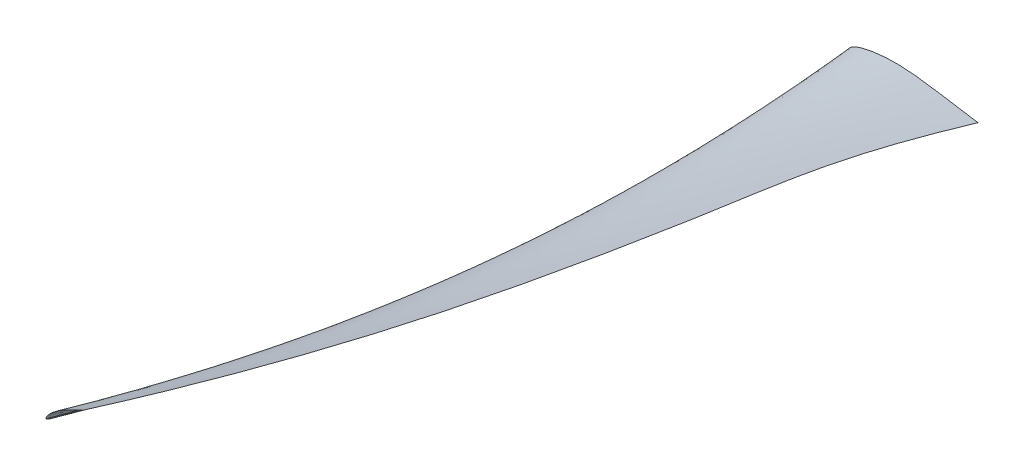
SolidWorks part; units mm, degrees
ref_plane "Plan de face" through (0, 0, 0) normal (0, 0, 1) x (1, 0, 0)
ref_plane "Plan de dessus" through (0, 0, 0) normal (0, 1, 0) x (1, 0, 0)
ref_plane "Plan de droite" through (0, 0, 0) normal (1, 0, 0) x (0, 0, -1)
ref_plane "Plan7" through (0, 0, 0) normal (0, 0, 1) x (1, 0, 0)
sketch "Esquisse7" plane through (0, 0, 0) normal (0, 0, 1) x (1, 0, 0)
  spline S0 degree 3 poles (0, 0) (0.01, 0.0779) (0.0566, 0.4389) (0.6038, 1.0375) (1.4835, 1.8363) (2.8511, 2.6404) (4.5884, 3.488) (6.7468, 4.3064) (9.2893, 5.0773) (12.1913, 5.8344) (15.4386, 6.4858) (18.9898, 7.0761) (22.8127, 7.5599) (26.8712, 7.9384) (31.13, 8.1902) (35.5567, 8.2799) (40.1224, 8.1907) (44.8051, 7.965) (49.5765, 7.5702) (54.409, 7.0333) (59.2707, 6.3995) (64.1131, 5.711) (68.879, 4.9915) (73.5011, 4.2633) (77.92, 3.5536) (82.0778, 2.8904) (85.909, 2.2574) (89.3679, 1.7074) (92.3959, 1.2022) (94.9606, 0.7907) (97.0187, 0.4452) (98.5362, 0.2104) (99.4689, 0.0649) (99.8933, 0.013) (100, 0) knots 0 0 0 0 0.002279 0.010565 0.02232 0.037625 0.05653 0.079028 0.105089 0.134331 0.166822 0.202049 0.239744 0.279649 0.321405 0.364661 0.409281 0.455122 0.50194 0.549472 0.597507 0.645525 0.692715 0.738665 0.78256 0.823791 0.861972 0.896286 0.926362 0.95188 0.972359 0.987477 0.996852 1 1 1 1
  spline S1 degree 3 poles (0, 0) (0.0216, -0.1028) (0.0957, -0.4562) (0.906, -0.754) (2.0288, -1.0924) (3.7758, -1.3043) (5.9941, -1.458) (8.7342, -1.512) (11.9532, -1.5081) (15.6306, -1.4432) (19.7237, -1.331) (24.1903, -1.1785) (28.9802, -0.9996) (34.0362, -0.7913) (39.3002, -0.6124) (44.7029, -0.4031) (50.183, -0.2273) (55.6731, -0.0668) (61.1032, 0.07) (66.4063, 0.1967) (71.5165, 0.2722) (76.3699, 0.3249) (80.9033, 0.3414) (85.0567, 0.3468) (88.7835, 0.3163) (92.0301, 0.2654) (94.7571, 0.2109) (96.9234, 0.1366) (98.5004, 0.0831) (99.4602, 0.0331) (99.89, 0.0068) (100, 0) knots 0 0 0 0 0.003023 0.010401 0.022533 0.03974 0.062002 0.089293 0.121454 0.1582 0.199139 0.243771 0.291698 0.342319 0.394926 0.44903 0.503823 0.558709 0.613093 0.666078 0.717164 0.765757 0.811062 0.852583 0.889823 0.922387 0.949576 0.971293 0.987136 0.996708 1 1 1 1
ref_plane "Plan8" through (0, 0, 100) normal (0, 0, 1) x (1, 0, 0)
sketch "Esquisse8" plane through (0, 0, 100) normal (0, 0, 1) x (1, 0, 0)
  line L0 (0, 0) -> (19.9239, 1.7431) construction
  line L1 (19.9239, 1.7431) -> (19.0523, 11.7051) construction
  line L2 (0, 0) -> (19.9239, 1.7431) construction
  line L3 (19.9239, 1.7431) -> (19.0523, 11.7051) construction
  spline S0 degree 3 poles (19.0523, 11.7051) (19.0546, 11.7605) (19.0651, 12.0177) (19.4137, 12.4731) (19.9842, 13.09) (20.8979, 13.7407) (22.0695, 14.4449) (23.5395, 15.1543) (25.283, 15.8541) (27.2805, 16.5662) (29.5278, 17.2252) (31.993, 17.8599) (34.6561, 18.4363) (37.4916, 18.953) (40.4761, 19.3928) (43.5887, 19.7288) (46.8104, 19.9474) (50.1229, 20.077) (53.5083, 20.0929) (56.9454, 20.0126) (60.4092, 19.8657) (63.8627, 19.6792) (67.2642, 19.4661) (70.5649, 19.2379) (73.7215, 19.0104) (76.6911, 18.7994) (79.4289, 18.5897) (81.8993, 18.4154) (84.0634, 18.2461) (85.8954, 18.1143) (87.3664, 17.9978) (88.4498, 17.9259) (89.1158, 17.8809) (89.418, 17.8705) (89.4939, 17.8679) knots 0 0 0 0 0.002279 0.010565 0.02232 0.037625 0.05653 0.079028 0.105089 0.134331 0.166822 0.202049 0.239744 0.279649 0.321405 0.364661 0.409281 0.455122 0.50194 0.549472 0.597507 0.645525 0.692715 0.738665 0.78256 0.823791 0.861972 0.896286 0.926362 0.95188 0.972359 0.987477 0.996852 1 1 1 1
  spline S1 degree 3 poles (19.0523, 11.7051) (19.0739, 11.634) (19.1479, 11.3896) (19.737, 11.2298) (20.5488, 11.0606) (21.7925, 11.019) (23.3645, 11.0474) (25.298, 11.1782) (27.5653, 11.3794) (30.1517, 11.6517) (33.0281, 11.983) (36.165, 12.3657) (39.5281, 12.7869) (43.0768, 13.2453) (46.7738, 13.6957) (50.5666, 14.1761) (54.4161, 14.6376) (58.2734, 15.0891) (62.0901, 15.5201) (65.8179, 15.9361) (69.4129, 16.3043) (72.8285, 16.6405) (76.0209, 16.9315) (78.9463, 17.1912) (81.5734, 17.3994) (83.8635, 17.5637) (85.7877, 17.6934) (87.3183, 17.7745) (88.4325, 17.834) (89.1116, 17.858) (89.416, 17.8659) (89.4939, 17.8679) knots 0 0 0 0 0.003023 0.010401 0.022533 0.03974 0.062002 0.089293 0.121454 0.1582 0.199139 0.243771 0.291698 0.342319 0.394926 0.44903 0.503823 0.558709 0.613093 0.666078 0.717164 0.765757 0.811062 0.852583 0.889823 0.922387 0.949576 0.971293 0.987136 0.996708 1 1 1 1
ref_plane "Plan9" through (0, 0, 200) normal (0, 0, 1) x (1, 0, 0)
sketch "Esquisse9" plane through (0, 0, 200) normal (0, 0, 1) x (1, 0, 0)
  line L0 (0, 0) -> (39.3923, 6.9459) construction
  line L1 (39.3923, 6.9459) -> (35.9193, 26.6421) construction
  line L2 (0, 0) -> (39.3923, 6.9459) construction
  line L3 (39.3923, 6.9459) -> (35.9193, 26.6421) construction
  spline S0 degree 3 poles (35.9193, 26.6421) (35.9172, 26.6874) (35.9075, 26.8973) (36.1586, 27.2925) (36.5787, 27.8349) (37.2757, 28.4292) (38.1785, 29.0853) (39.3237, 29.767) (40.692, 30.4602) (42.2661, 31.1816) (44.0472, 31.8776) (46.0071, 32.5693) (48.1323, 33.2276) (50.4019, 33.8497) (52.7981, 34.4198) (55.306, 34.9146) (57.9109, 35.3216) (60.5961, 35.6628) (63.3486, 35.9166) (66.15, 36.0959) (68.9778, 36.2229) (71.8001, 36.317) (74.582, 36.3857) (77.2831, 36.435) (79.8668, 36.4745) (82.2973, 36.5143) (84.5391, 36.5385) (86.5609, 36.5725) (88.3332, 36.5888) (89.8327, 36.612) (91.0375, 36.6219) (91.9238, 36.6405) (92.4687, 36.6513) (92.7153, 36.6644) (92.7772, 36.6677) knots 0 0 0 0 0.002279 0.010565 0.02232 0.037625 0.05653 0.079028 0.105089 0.134331 0.166822 0.202049 0.239744 0.279649 0.321405 0.364661 0.409281 0.455122 0.50194 0.549472 0.597507 0.645525 0.692715 0.738665 0.78256 0.823791 0.861972 0.896286 0.926362 0.95188 0.972359 0.987477 0.996852 1 1 1 1
  spline S1 degree 3 poles (35.9193, 26.6421) (35.9419, 26.5858) (36.0195, 26.3923) (36.51, 26.3042) (37.1824, 26.2243) (38.197, 26.2791) (39.4736, 26.414) (41.037, 26.658) (42.8669, 26.983) (44.9513, 27.3886) (47.2673, 27.8627) (49.7916, 28.3972) (52.4971, 28.9791) (55.351, 29.6045) (58.326, 30.2339) (61.3769, 30.8946) (64.4752, 31.544) (67.5806, 32.1857) (70.6543, 32.8078) (73.6568, 33.4115) (76.5548, 33.9668) (79.3091, 34.4833) (81.885, 34.9472) (84.246, 35.3667) (86.3681, 35.723) (88.2192, 36.0195) (89.7751, 36.2619) (91.0143, 36.4369) (91.9163, 36.5646) (92.467, 36.6324) (92.714, 36.6605) (92.7772, 36.6677) knots 0 0 0 0 0.003023 0.010401 0.022533 0.03974 0.062002 0.089293 0.121454 0.1582 0.199139 0.243771 0.291698 0.342319 0.394926 0.44903 0.503823 0.558709 0.613093 0.666078 0.717164 0.765757 0.811062 0.852583 0.889823 0.922387 0.949576 0.971293 0.987136 0.996708 1 1 1 1
ref_plane "Plan10" through (0, 0, 300) normal (0, 0, 1) x (1, 0, 0)
sketch "Esquisse10" plane through (0, 0, 300) normal (0, 0, 1) x (1, 0, 0)
  line L0 (0, 0) -> (57.9555, 15.5291) construction
  line L1 (57.9555, 15.5291) -> (50.191, 44.5069) construction
  line L2 (0, 0) -> (57.9555, 15.5291) construction
  line L3 (57.9555, 15.5291) -> (50.191, 44.5069) construction
  spline S0 degree 3 poles (50.191, 44.5069) (50.1857, 44.5458) (50.1615, 44.7262) (50.3483, 45.0861) (50.6698, 45.5857) (51.2262, 46.1511) (51.9556, 46.7853) (52.8922, 47.4598) (54.0203, 48.1612) (55.3239, 48.9024) (56.8079, 49.6372) (58.4466, 50.3819) (60.2303, 51.1103) (62.1415, 51.8183) (64.1657, 52.491) (66.292, 53.1072) (68.5087, 53.6549) (70.7994, 54.1519) (73.1549, 54.5787) (75.5583, 54.9448) (77.9884, 55.2678) (80.4162, 55.562) (82.811, 55.8312) (85.1376, 56.0777) (87.3636, 56.3068) (89.4575, 56.5245) (91.3897, 56.7146) (93.1314, 56.8966) (94.6592, 57.0444) (95.9511, 57.1776) (96.9898, 57.2771) (97.7531, 57.36) (98.2223, 57.4105) (98.434, 57.4404) (98.4873, 57.4479) knots 0 0 0 0 0.002279 0.010565 0.02232 0.037625 0.05653 0.079028 0.105089 0.134331 0.166822 0.202049 0.239744 0.279649 0.321405 0.364661 0.409281 0.455122 0.50194 0.549472 0.597507 0.645525 0.692715 0.738665 0.78256 0.823791 0.861972 0.896286 0.926362 0.95188 0.972359 0.987477 0.996852 1 1 1 1
  spline S1 degree 3 poles (50.191, 44.5069) (50.2147, 44.4601) (50.2962, 44.299) (50.7261, 44.26) (51.3122, 44.2419) (52.1833, 44.3656) (53.2746, 44.5784) (54.6049, 44.907) (56.1591, 45.3254) (57.9267, 45.8326) (59.8891, 46.4165) (62.0265, 47.0682) (64.3167, 47.7744) (66.7316, 48.5294) (69.2508, 49.297) (71.833, 50.0972) (74.4569, 50.8913) (77.0876, 51.6793) (79.6925, 52.4481) (82.2373, 53.1955) (84.6956, 53.8933) (87.0328, 54.5468) (89.2201, 55.1415) (91.2253, 55.6815) (93.0292, 56.1491) (94.6038, 56.5447) (95.9278, 56.8712) (96.9837, 57.1157) (97.7523, 57.2939) (98.2223, 57.394) (98.4333, 57.4369) (98.4873, 57.4479) knots 0 0 0 0 0.003023 0.010401 0.022533 0.03974 0.062002 0.089293 0.121454 0.1582 0.199139 0.243771 0.291698 0.342319 0.394926 0.44903 0.503823 0.558709 0.613093 0.666078 0.717164 0.765757 0.811062 0.852583 0.889823 0.922387 0.949576 0.971293 0.987136 0.996708 1 1 1 1
ref_plane "Plan11" through (0, 0, 400) normal (0, 0, 1) x (1, 0, 0)
sketch "Esquisse11" plane through (0, 0, 400) normal (0, 0, 1) x (1, 0, 0)
  line L0 (0, 0) -> (75.1754, 27.3616) construction
  line L1 (75.1754, 27.3616) -> (61.4946, 64.9493) construction
  line L2 (0, 0) -> (75.1754, 27.3616) construction
  line L3 (75.1754, 27.3616) -> (61.4946, 64.9493) construction
  spline S0 degree 3 poles (61.4946, 64.9493) (61.4869, 64.9836) (61.4513, 65.1424) (61.5896, 65.4777) (61.8372, 65.9479) (62.2889, 66.495) (62.8893, 67.117) (63.6712, 67.791) (64.6218, 68.5039) (65.7255, 69.2659) (66.9905, 70.0364) (68.3926, 70.8276) (69.9252, 71.6157) (71.5728, 72.3955) (73.324, 73.1527) (75.1706, 73.8675) (77.103, 74.5284) (79.1054, 75.1498) (81.1709, 75.7136) (83.2838, 76.2272) (85.4239, 76.7045) (87.5642, 77.1558) (89.677, 77.5824) (91.7308, 77.9834) (93.6964, 78.361) (95.5452, 78.7183) (97.252, 79.0383) (98.7897, 79.3362) (100.1395, 79.587) (101.2802, 79.8064) (102.198, 79.976) (102.8716, 80.1094) (103.2858, 80.191) (103.4721, 80.2341) (103.5189, 80.2449) knots 0 0 0 0 0.002279 0.010565 0.02232 0.037625 0.05653 0.079028 0.105089 0.134331 0.166822 0.202049 0.239744 0.279649 0.321405 0.364661 0.409281 0.455122 0.50194 0.549472 0.597507 0.645525 0.692715 0.738665 0.78256 0.823791 0.861972 0.896286 0.926362 0.95188 0.972359 0.987477 0.996852 1 1 1 1
  spline S1 degree 3 poles (61.4946, 64.9493) (61.5194, 64.9094) (61.6046, 64.7722) (61.9906, 64.771) (62.5143, 64.8005) (63.2809, 64.9787) (64.2366, 65.2534) (65.3964, 65.6499) (66.7485, 66.1439) (68.284, 66.7336) (69.987, 67.4068) (71.8407, 68.1541) (73.8263, 68.9619) (75.9191, 69.8228) (78.1039, 70.7032) (80.3423, 71.6175) (82.6185, 72.5296) (84.901, 73.4368) (87.1621, 74.3248) (89.3713, 75.1892) (91.5073, 76.0026) (93.5388, 76.7671) (95.4415, 77.4674) (97.1861, 78.105) (98.7569, 78.6622) (100.1291, 79.1374) (101.2834, 79.5316) (102.2051, 79.8317) (102.876, 80.0505) (103.287, 80.1763) (103.4717, 80.2309) (103.5189, 80.2449) knots 0 0 0 0 0.003023 0.010401 0.022533 0.03974 0.062002 0.089293 0.121454 0.1582 0.199139 0.243771 0.291698 0.342319 0.394926 0.44903 0.503823 0.558709 0.613093 0.666078 0.717164 0.765757 0.811062 0.852583 0.889823 0.922387 0.949576 0.971293 0.987136 0.996708 1 1 1 1
ref_plane "Plan12" through (0, 0, 500) normal (0, 0, 1) x (1, 0, 0)
sketch "Esquisse12" plane through (0, 0, 500) normal (0, 0, 1) x (1, 0, 0)
  line L0 (0, 0) -> (90.6308, 42.2618) construction
  line L1 (90.6308, 42.2618) -> (69.4999, 87.5772) construction
  line L2 (0, 0) -> (90.6308, 42.2618) construction
  line L3 (90.6308, 42.2618) -> (69.4999, 87.5772) construction
  spline S0 degree 3 poles (69.4999, 87.5772) (69.4901, 87.6078) (69.4451, 87.7494) (69.5443, 88.0653) (69.7319, 88.5126) (70.0992, 89.0461) (70.5958, 89.6594) (71.2532, 90.3346) (72.0609, 91.0585) (73.004, 91.8393) (74.0931, 92.6406) (75.3052, 93.4717) (76.6362, 94.3103) (78.0725, 95.1506) (79.6048, 95.9785) (81.2272, 96.7755) (82.9319, 97.5302) (84.7035, 98.2546) (86.537, 98.9318) (88.4176, 99.5669) (90.3258, 100.1712) (92.2363, 100.7519) (94.1238, 101.308) (95.9596, 101.836) (97.7171, 102.3358) (99.3698, 102.8078) (100.8966, 103.2346) (102.2713, 103.6279) (103.4788, 103.9634) (104.4987, 104.2536) (105.3198, 104.4809) (105.9218, 104.6558) (106.292, 104.7629) (106.458, 104.8169) (106.4997, 104.8305) knots 0 0 0 0 0.002279 0.010565 0.02232 0.037625 0.05653 0.079028 0.105089 0.134331 0.166822 0.202049 0.239744 0.279649 0.321405 0.364661 0.409281 0.455122 0.50194 0.549472 0.597507 0.645525 0.692715 0.738665 0.78256 0.823791 0.861972 0.896286 0.926362 0.95188 0.972359 0.987477 0.996852 1 1 1 1
  spline S1 degree 3 poles (69.4999, 87.5772) (69.5256, 87.5429) (69.614, 87.4249) (69.9651, 87.4546) (70.439, 87.523) (71.1219, 87.7461) (71.9692, 88.0719) (72.9924, 88.5247) (74.1827, 89.0816) (75.5322, 89.74) (77.0273, 90.4877) (78.6536, 91.3148) (80.395, 92.2074) (82.2297, 93.1568) (84.1466, 94.1312) (86.1094, 95.1408) (88.1067, 96.1514) (90.1103, 97.158) (92.0959, 98.1454) (94.0362, 99.1073) (95.9139, 100.0169) (97.7006, 100.8738) (99.3751, 101.662) (100.9109, 102.3806) (102.2951, 103.0123) (103.5051, 103.5537) (104.5235, 104.004) (105.3378, 104.3503) (105.9305, 104.6026) (106.2943, 104.7497) (106.4579, 104.8141) (106.4997, 104.8305) knots 0 0 0 0 0.003023 0.010401 0.022533 0.03974 0.062002 0.089293 0.121454 0.1582 0.199139 0.243771 0.291698 0.342319 0.394926 0.44903 0.503823 0.558709 0.613093 0.666078 0.717164 0.765757 0.811062 0.852583 0.889823 0.922387 0.949576 0.971293 0.987136 0.996708 1 1 1 1
ref_plane "Plan13" through (0, 0, 600) normal (0, 0, 1) x (1, 0, 0)
sketch "Esquisse13" plane through (0, 0, 600) normal (0, 0, 1) x (1, 0, 0)
  line L0 (0, 0) -> (103.923, 60) construction
  line L1 (103.923, 60) -> (73.923, 111.9615) construction
  line L2 (0, 0) -> (103.923, 60) construction
  line L3 (103.923, 60) -> (73.923, 111.9615) construction
  spline S0 degree 3 poles (73.923, 111.9615) (73.9116, 111.9889) (73.8586, 112.1159) (73.9246, 112.4152) (74.0616, 112.8429) (74.3573, 113.3646) (74.7658, 113.9704) (75.3176, 114.6461) (76.0042, 115.379) (76.811, 116.1752) (77.7508, 117.0021) (78.8016, 117.8665) (79.9616, 118.7473) (81.2185, 119.6382) (82.5649, 120.5254) (83.9969, 121.3913) (85.5083, 122.225) (87.0837, 123.036) (88.7201, 123.8085) (90.4034, 124.546) (92.1145, 125.2574) (93.8297, 125.9471) (95.5257, 126.6123) (97.1762, 127.2474) (98.7568, 127.8502) (100.2431, 128.4189) (101.6168, 128.9357) (102.8529, 129.4094) (103.9395, 129.8162) (104.8568, 130.1662) (105.5957, 130.4421) (106.1368, 130.652) (106.4696, 130.7806) (106.6183, 130.8438) (106.6557, 130.8597) knots 0 0 0 0 0.002279 0.010565 0.02232 0.037625 0.05653 0.079028 0.105089 0.134331 0.166822 0.202049 0.239744 0.279649 0.321405 0.364661 0.409281 0.455122 0.50194 0.549472 0.597507 0.645525 0.692715 0.738665 0.78256 0.823791 0.861972 0.896286 0.926362 0.95188 0.972359 0.987477 0.996852 1 1 1 1
  spline S1 degree 3 poles (73.923, 111.9615) (73.9495, 111.932) (74.0406, 111.8303) (74.3621, 111.8859) (74.7936, 111.9873) (75.4055, 112.2482) (76.1606, 112.6171) (77.0677, 113.1172) (78.1206, 113.7268) (79.3121, 114.443) (80.6307, 115.2533) (82.0639, 116.1473) (83.598, 117.1111) (85.2135, 118.1348) (86.9028, 119.1881) (88.6317, 120.2776) (90.3923, 121.3708) (92.159, 122.4609) (93.9105, 123.5319) (95.6224, 124.5755) (97.2809, 125.566) (98.8596, 126.5004) (100.3404, 127.3626) (101.6989, 128.1492) (102.9245, 128.8435) (103.9968, 129.4405) (104.8997, 129.938) (105.6229, 130.323) (106.1492, 130.6036) (106.4728, 130.7686) (106.6185, 130.8412) (106.6557, 130.8597) knots 0 0 0 0 0.003023 0.010401 0.022533 0.03974 0.062002 0.089293 0.121454 0.1582 0.199139 0.243771 0.291698 0.342319 0.394926 0.44903 0.503823 0.558709 0.613093 0.666078 0.717164 0.765757 0.811062 0.852583 0.889823 0.922387 0.949576 0.971293 0.987136 0.996708 1 1 1 1
ref_plane "Plan14" through (0, 0, 700) normal (0, 0, 1) x (1, 0, 0)
sketch "Esquisse14" plane through (0, 0, 700) normal (0, 0, 1) x (1, 0, 0)
  line L0 (0, 0) -> (114.6813, 80.3007) construction
  line L1 (114.6813, 80.3007) -> (74.5309, 137.6413) construction
  line L2 (0, 0) -> (114.6813, 80.3007) construction
  line L3 (114.6813, 80.3007) -> (74.5309, 137.6413) construction
  spline S0 degree 3 poles (74.5309, 137.6413) (74.5181, 137.6659) (74.4583, 137.7799) (74.4954, 138.0643) (74.5882, 138.474) (74.8212, 138.9842) (75.1525, 139.582) (75.6116, 140.2567) (76.1916, 140.9956) (76.8786, 141.8033) (77.6869, 142.6505) (78.5957, 143.5416) (79.6047, 144.457) (80.7034, 145.3896) (81.8857, 146.3262) (83.1496, 147.2498) (84.49, 148.1499) (85.8919, 149.0341) (87.3538, 149.8874) (88.8622, 150.7119) (90.3988, 151.5142) (91.9408, 152.2968) (93.467, 153.0549) (94.9533, 153.7813) (96.377, 154.4719) (97.7157, 155.123) (98.9536, 155.7166) (100.0669, 156.2587) (101.0463, 156.7265) (101.8725, 157.1274) (102.5386, 157.4447) (103.0257, 157.6844) (103.3253, 157.8314) (103.4588, 157.9025) (103.4923, 157.9203) knots 0 0 0 0 0.002279 0.010565 0.02232 0.037625 0.05653 0.079028 0.105089 0.134331 0.166822 0.202049 0.239744 0.279649 0.321405 0.364661 0.409281 0.455122 0.50194 0.549472 0.597507 0.645525 0.692715 0.738665 0.78256 0.823791 0.861972 0.896286 0.926362 0.95188 0.972359 0.987477 0.996852 1 1 1 1
  spline S1 degree 3 poles (74.5309, 137.6413) (74.558, 137.616) (74.6512, 137.5286) (74.9462, 137.6067) (75.34, 137.7364) (75.889, 138.0293) (76.5626, 138.4346) (77.3671, 138.9747) (78.2986, 139.6286) (79.3504, 140.3931) (80.5131, 141.2556) (81.7758, 142.2056) (83.1267, 143.2287) (84.5488, 144.3144) (86.037, 145.4337) (87.5593, 146.5899) (89.1107, 147.7521) (90.6682, 148.9119) (92.2131, 150.0527) (93.7232, 151.1648) (95.1879, 152.223) (96.5828, 153.2225) (97.8924, 154.1466) (99.0942, 154.9904) (100.1797, 155.7373) (101.1303, 156.381) (101.9311, 156.9182) (102.5736, 157.336) (103.0412, 157.6403) (103.3293, 157.8205) (103.4591, 157.9) (103.4923, 157.9203) knots 0 0 0 0 0.003023 0.010401 0.022533 0.03974 0.062002 0.089293 0.121454 0.1582 0.199139 0.243771 0.291698 0.342319 0.394926 0.44903 0.503823 0.558709 0.613093 0.666078 0.717164 0.765757 0.811062 0.852583 0.889823 0.922387 0.949576 0.971293 0.987136 0.996708 1 1 1 1
surface "Surface-Lissage1"
sketch3d "Esquisse3D1"
  line L0 (0, 0, 0) -> (0, 0, 750.9809)
  line L1 (0, 0, 0) -> (0, 158.2448, 0)
  line L2 (0, 0, 0) -> (185.0969, 0, 0)
